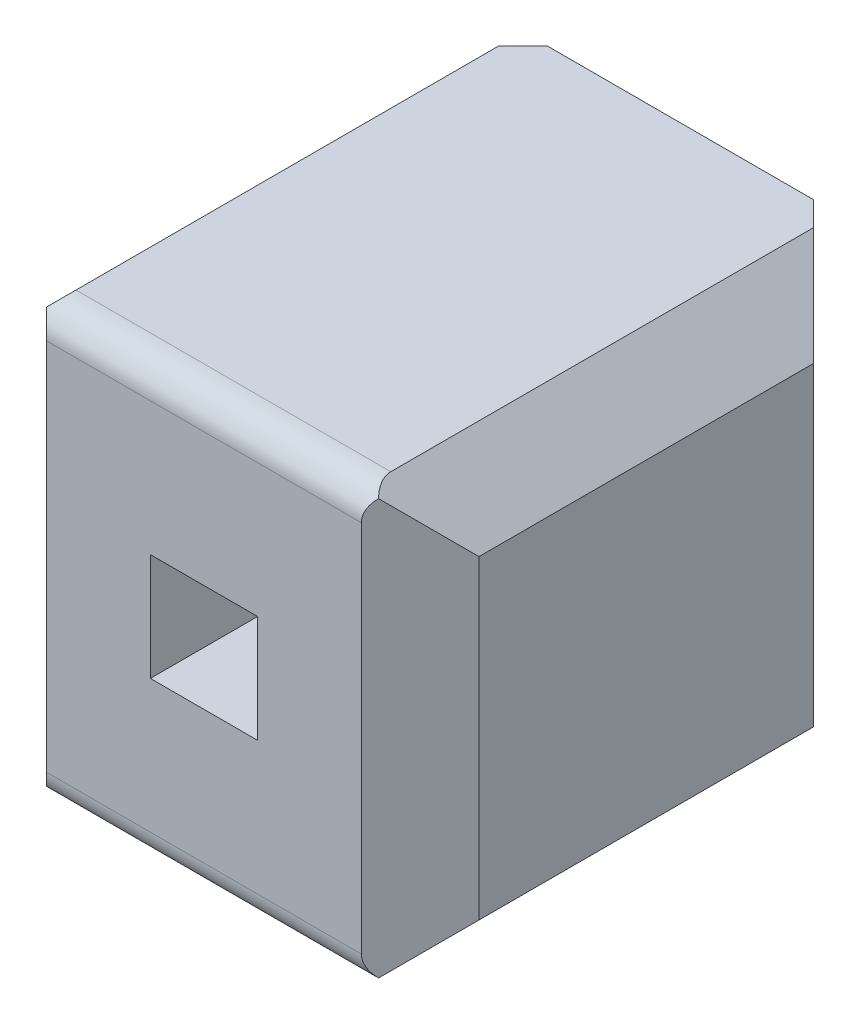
SolidWorks part; units mm, degrees
ref_plane "Front Plane" through (0, 0, 0) normal (0, 0, 1) x (1, 0, 0)
ref_plane "Top Plane" through (0, 0, 0) normal (0, 1, 0) x (1, 0, 0)
ref_plane "Right Plane" through (0, 0, 0) normal (1, 0, 0) x (0, 0, -1)
ref_plane "Plane1" through (0, -0.77, 0) normal (0, -1, 0) x (1, 0, 0)
sketch "Sketch1" plane through (0, -0.77, 0) normal (0, -1, 0) x (1, 0, 0)
  line L0 (29.02, 0.3) -> (29.21, 0.49)
  line L1 (29.21, 0.49) -> (26.67, 0.49)
  line L2 (26.67, 0.49) -> (26.86, 0.3)
  line L3 (26.86, 0.3) -> (29.02, 0.3)
extrude "Boss-Extrude1" add sketch "Sketch1" against normal blind 1.54
sketch "Sketch2" plane through (0, 0.77, 0) normal (0, 1, 0) x (-1, 0, 0)
  line L0 (-26.67, 0.49) -> (-27.1586, 0.0014)
  line L1 (-27.1586, 0.0014) -> (-28.7214, 0.0014)
  line L2 (-28.7214, 0.0014) -> (-29.21, 0.49)
  line L3 (-29.21, 0.49) -> (-26.67, 0.49)
extrude "Boss-Extrude2" add sketch "Sketch2" along normal blind 0.5
sketch "Sketch3" plane through (0, 0, 0.49) normal (0, 0, 1) x (1, 0, 0)
  line L0 (26.67, -0.77) -> (26.67, 1.27)
  line L1 (26.67, 1.27) -> (29.21, 1.27)
  line L2 (29.21, 1.27) -> (29.21, -0.77)
  line L3 (29.21, -0.77) -> (26.67, -0.77)
extrude "Boss-Extrude3" add sketch "Sketch3" along normal blind 2.31
sketch "Sketch4" plane through (0, -0.77, 0) normal (0, -1, 0) x (1, 0, 0)
  line L0 (29.21, 0.49) -> (28.7214, 0.0014)
  line L1 (28.7214, 0.0014) -> (27.1586, 0.0014)
  line L2 (27.1586, 0.0014) -> (26.67, 0.49)
  line L3 (26.67, 0.49) -> (26.67, 2.8)
  line L4 (26.67, 2.8) -> (29.21, 2.8)
  line L5 (29.21, 2.8) -> (29.21, 0.49)
extrude "Boss-Extrude4" add sketch "Sketch4" along normal blind 0.5
sketch "Sketch5" plane through (0, 0, 2.8) normal (0, 0, 1) x (1, 0, 0)
  line L0 (28.255, -0.315) -> (28.255, 0.315)
  line L1 (28.255, 0.315) -> (27.625, 0.315)
  line L2 (27.625, 0.315) -> (27.625, -0.315)
  line L3 (27.625, -0.315) -> (28.255, -0.315)
extrude "Cut-Extrude1" cut sketch "Sketch5" against normal through all
chamfer "Chamfer1" distance 0.3455 angle 45 6 edges at (29.21, 1.27, 1.645) (29.21, 0, 2.8) (29.21, -1.27, 1.645) (26.67, -1.27, 1.645) (26.67, 1.27, 1.645) (26.67, 0, 2.8)
fillet "Fillet1" radius 0.1727 2 edges at (27.94, -1.27, 2.8) (27.94, 1.27, 2.8)
